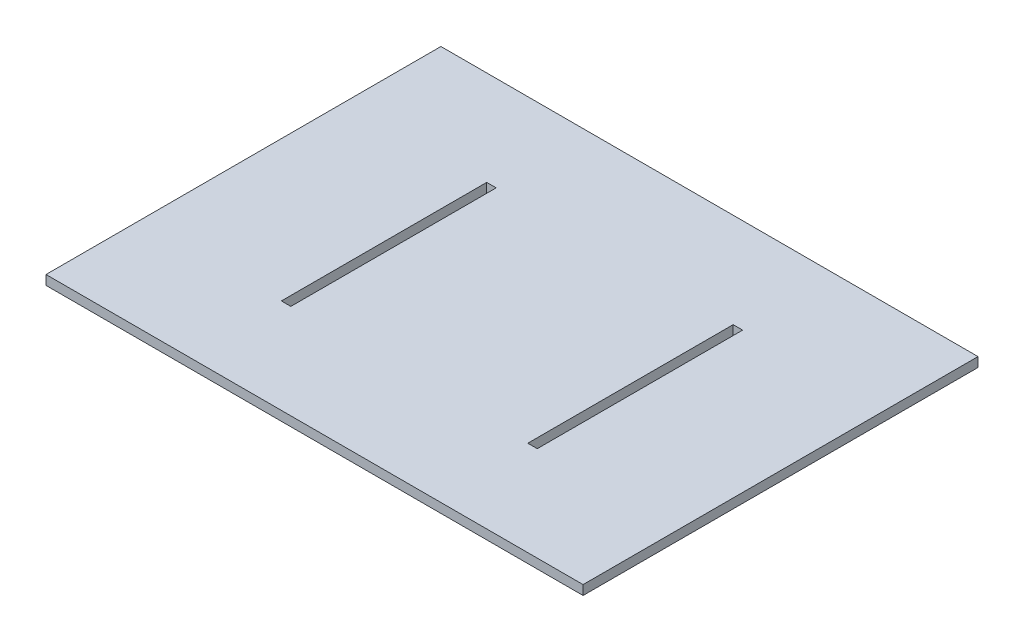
SolidWorks part; units mm, degrees
ref_plane "Front Plane" through (0, 0, 0) normal (0, 0, 1) x (1, 0, 0)
ref_plane "Top Plane" through (0, 0, 0) normal (0, 1, 0) x (1, 0, 0)
ref_plane "Right Plane" through (0, 0, 0) normal (1, 0, 0) x (0, 0, -1)
sketch "Sketch1" plane through (0, 0, 0) normal (0, 1, 0) x (1, 0, 0)
  line L1 (0, 0) -> (680, 0)
  line L2 (0, 0) -> (0, 500)
  line L3 (0, 500) -> (680, 500)
  line L4 (680, 0) -> (680, 500)
  dimension "D1" = 500
  dimension "D2" = 680
extrude "Boss-Extrude1" add sketch "Sketch1" along normal blind 12
sketch "Sketch2" plane through (0, 12, 0) normal (0, 1, 0) x (1, 0, 0)
  line L0 (340, 500) -> (340, 0) construction
  line L1 (680, 500) -> (0, 500) construction
  line L2 (0, 0) -> (680, 0) construction
  line L3 (0, 500) -> (0, 0) construction
  line L4 (680, 0) -> (680, 500) construction
  line L7 (178, 380) -> (190, 380)
  line L8 (178, 380) -> (178, 120)
  line L9 (178, 120) -> (190, 120)
  line L10 (190, 380) -> (190, 120)
  line L11 (490, 380) -> (502, 380)
  line L12 (490, 380) -> (490, 120)
  line L13 (490, 120) -> (502, 120)
  line L14 (502, 380) -> (502, 120)
  dimension "D1" = 150
  dimension "D2" = 150
  dimension "D3" = 12
  dimension "D4" = 178
  dimension "D5" = 178
  dimension "D9" = 12
extrude "Cut-Extrude3" cut sketch "Sketch2" against normal blind 14
